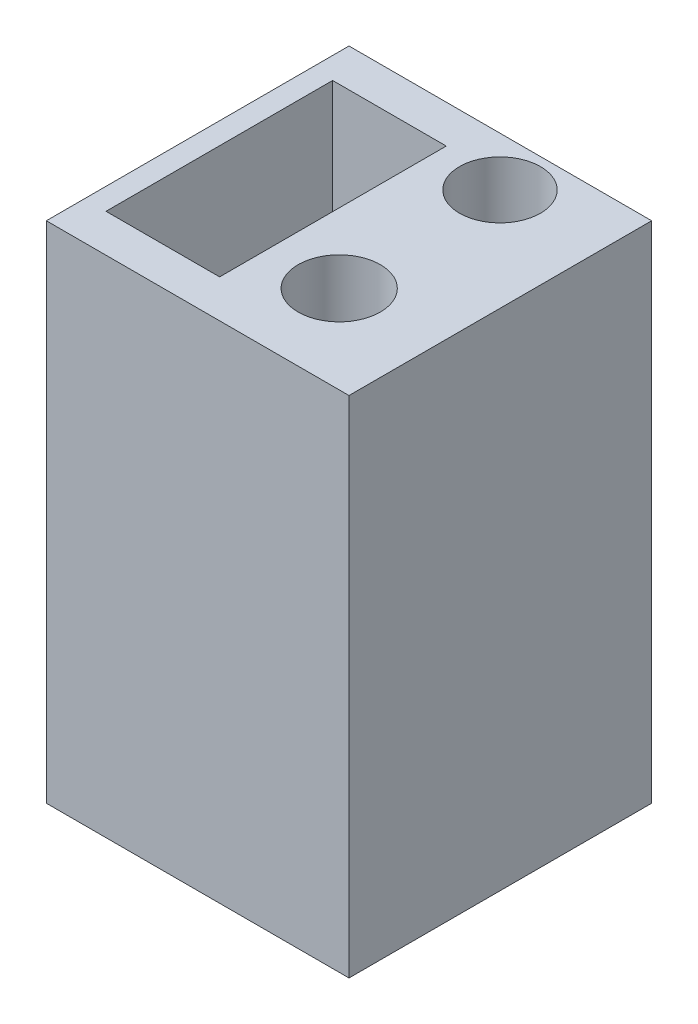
SolidWorks part; units mm, degrees
ref_plane "Front Plane" through (0, 0, 0) normal (0, 0, 1) x (1, 0, 0)
ref_plane "Top Plane" through (0, 0, 0) normal (0, 1, 0) x (1, 0, 0)
ref_plane "Right Plane" through (0, 0, 0) normal (1, 0, 0) x (0, 0, -1)
sketch "Sketch1" plane through (0, 0, 0) normal (0, 1, 0) x (1, 0, 0)
  line L1 (-15, -15) -> (15, -15)
  line L2 (-15, -15) -> (-15, 15)
  line L3 (-15, 15) -> (15, 15)
  line L4 (15, -15) -> (15, 15)
  line L5 (-15, -15) -> (15, 15) construction
  line L6 (-15, 15) -> (15, -15) construction
  point P0 (0, 0)
  dimension "D1" = 30
  dimension "D2" = 30
extrude "Boss-Extrude1" add sketch "Sketch1" along normal blind 50
sketch "Sketch2" plane through (0, 50, 0) normal (0, 1, 0) x (1, 0, 0)
  line L1 (-12.8536, -11.2316) -> (-1.5914, -11.2316)
  line L2 (-12.8536, -11.2316) -> (-12.8536, 11.2316)
  line L3 (-12.8536, 11.2316) -> (-1.5914, 11.2316)
  line L4 (-1.5914, -11.2316) -> (-1.5914, 11.2316)
  line L5 (-12.8536, -11.2316) -> (-1.5914, 11.2316) construction
  line L6 (-12.8536, 11.2316) -> (-1.5914, -11.2316) construction
  circle A0 centre (4.8354, 10.1299) radius 4.0104
  circle A1 centre (5.3182, -6.2874) radius 4.0745
  point P0 (-7.2225, 0)
  dimension "D1" = 8.0208
  dimension "D2" = 8.149
extrude "Cut-Extrude1" cut sketch "Sketch2" against normal blind 44.412
sketch "Sketch4" plane through (0, 5.588, 0) normal (0, 1, 0) x (1, 0, 0)
  line L1 (7.523, 12.517) -> (4.1009, 13.7924)
  line L2 (4.1009, 13.7924) -> (1.2854, 11.4665)
  line L3 (1.2854, 11.4665) -> (1.8919, 7.8652)
  line L4 (1.8919, 7.8652) -> (5.3139, 6.5898)
  line L5 (5.3139, 6.5898) -> (8.1295, 8.9157)
  line L6 (8.1295, 8.9157) -> (7.523, 12.517)
  line L7 (6.7217, -2.4623) -> (2.7073, -3.1594)
  line L8 (2.7073, -3.1594) -> (1.3038, -6.9846)
  line L9 (1.3038, -6.9846) -> (3.9147, -10.1126)
  line L10 (3.9147, -10.1126) -> (7.9292, -9.4155)
  line L11 (7.9292, -9.4155) -> (9.3326, -5.5903)
  line L12 (9.3326, -5.5903) -> (6.7217, -2.4623)
  circle A0 centre (4.7074, 10.1911) radius 3.1627 construction
  circle A1 centre (5.3182, -6.2874) radius 3.5286 construction
